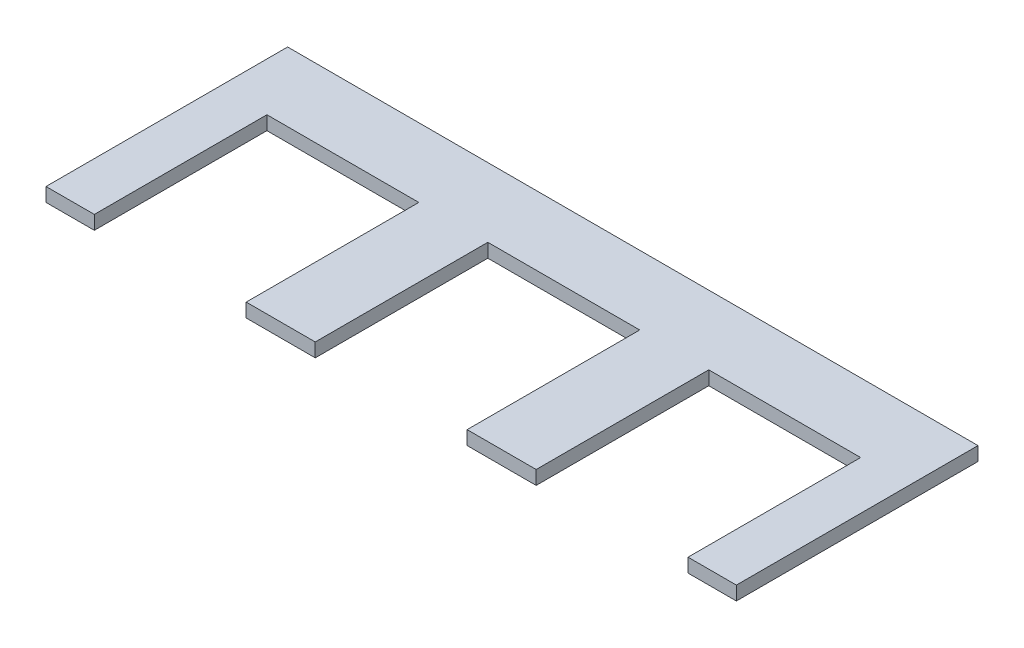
SolidWorks part; units mm, degrees
ref_plane "Front Plane" through (0, 0, 0) normal (0, 0, 1) x (1, 0, 0)
ref_plane "Top Plane" through (0, 0, 0) normal (0, 1, 0) x (1, 0, 0)
ref_plane "Right Plane" through (0, 0, 0) normal (1, 0, 0) x (0, 0, -1)
sketch "Sketch2" plane through (0, 0, 0) normal (0, 1, 0) x (1, 0, 0)
  line L1 (-500, -175) -> (500, -175)
  line L2 (-500, -175) -> (-500, 175)
  line L3 (-500, 175) -> (500, 175)
  line L4 (500, -175) -> (500, 175)
  line L5 (-500, -175) -> (500, 175) construction
  line L6 (-500, 175) -> (500, -175) construction
  point P0 (0, 0)
  dimension "D1" = 1000
  dimension "D2" = 350
extrude "Boss-Extrude1" add sketch "Sketch2" along normal blind 20
sketch "Sketch3" plane through (0, 20, 0) normal (0, 1, 0) x (1, 0, 0)
  line L0 (-500, -175) -> (500, -175) construction
  line L1 (-110, -175) -> (110, -175)
  line L2 (-110, -175) -> (-110, 75)
  line L3 (-110, 75) -> (110, 75)
  line L4 (110, -175) -> (110, 75)
  line L5 (0, 175) -> (0, -175) construction
  line L7 (500, 175) -> (-500, 175) construction
  line L8 (210, -175) -> (210, 75)
  line L9 (-430, -175) -> (-210, -175)
  line L10 (-430, -175) -> (-430, 75)
  line L11 (-430, 75) -> (-210, 75)
  line L12 (-210, -175) -> (-210, 75)
  line L13 (430, 75) -> (210, 75)
  line L14 (430, -175) -> (430, 75)
  line L15 (430, -175) -> (210, -175)
  dimension "D1" = 220
  dimension "D2" = 250
  dimension "D3" = 250
  dimension "D4" = 220
  dimension "D5" = 100
extrude "Cut-Extrude1" cut sketch "Sketch3" against normal blind 20
